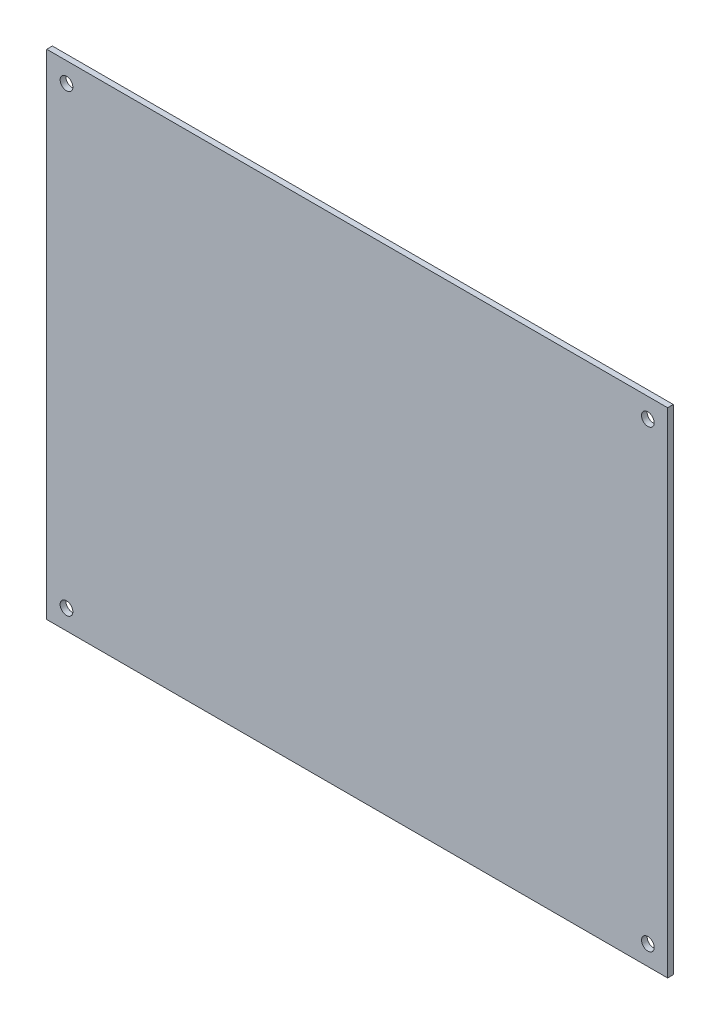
SolidWorks part; units mm, degrees
ref_plane "Front Plane" through (0, 0, 0) normal (0, 0, 1) x (1, 0, 0)
ref_plane "Top Plane" through (0, 0, 0) normal (0, 1, 0) x (1, 0, 0)
ref_plane "Right Plane" through (0, 0, 0) normal (1, 0, 0) x (0, 0, -1)
sketch "Sketch1" plane through (0, 0, 0) normal (0, 0, 1) x (1, 0, 0)
  line L1 (0, 0) -> (220, 0)
  line L2 (0, 0) -> (0, 175)
  line L3 (0, 175) -> (220, 175)
  line L4 (220, 0) -> (220, 175)
extrude "Boss-Extrude1" add sketch "Sketch1" along normal blind 2
sketch "Sketch2" plane through (0, 0, 2) normal (0, 0, 1) x (1, 0, 0)
  line L1 (7, 7) -> (213, 7) construction
  line L2 (7, 7) -> (7, 168) construction
  line L3 (7, 168) -> (213, 168) construction
  line L4 (213, 7) -> (213, 168) construction
  circle A0 centre (7, 168) radius 2.25
  circle A1 centre (213, 168) radius 2.25
  circle A2 centre (213, 7) radius 2.25
  circle A3 centre (7, 7) radius 2.25
  dimension "D1" = 4.5
extrude "Cut-Extrude1" cut sketch "Sketch2" against normal through all
